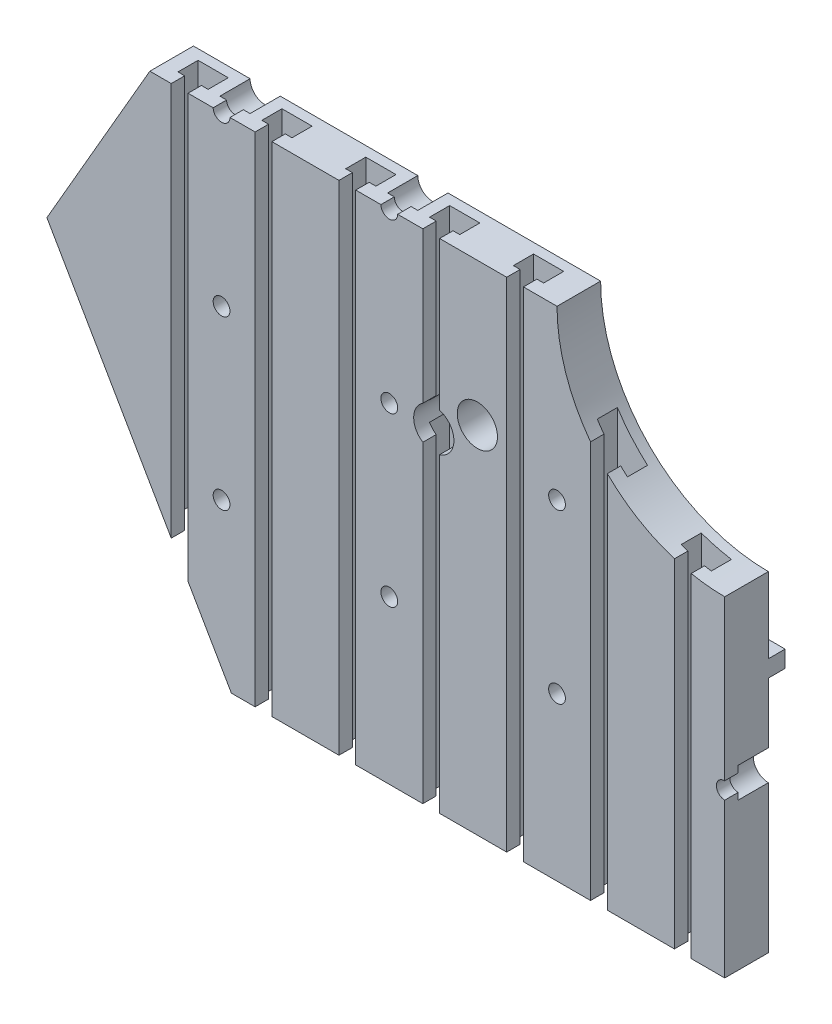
SolidWorks part; units mm, degrees
ref_plane "Plan de face" through (0, 0, 0) normal (0, 0, 1) x (1, 0, 0)
ref_plane "Plan de dessus" through (0, 0, 0) normal (0, 1, 0) x (1, 0, 0)
ref_plane "Plan de droite" through (0, 0, 0) normal (1, 0, 0) x (0, 0, -1)
sketch "Esquisse1" plane through (0, 0, 0) normal (0, 0, 1) x (1, 0, 0)
  line L6 (35.7636, 358.7862) -> (-423.8647, -437.3133) construction
  line L7 (-755.4678, -148.4209) -> (879.7592, -148.4209) construction
  line L8 (-46.1325, 376.7457) -> (415.4529, -422.7436) construction
  line L9 (257.0726, -148.4209) -> (-245.0999, 141.5085) construction
  line L10 (-257.0726, -148.4209) -> (263.2247, 151.9729) construction
  line L11 (-55, 201.5791) -> (55, 201.5791)
  line L12 (-147.0726, -148.4209) -> (147.0726, -148.4209)
  line L13 (147.0726, -148.4209) -> (202.0726, -53.1581)
  line L14 (202.0726, -53.1581) -> (55, 201.5791)
  line L15 (-147.0726, -148.4209) -> (-202.0726, -53.1581)
  line L16 (-202.0726, -53.1581) -> (-55, 201.5791)
  dimension "D1" = 60
  dimension "D2" = 60
  dimension "D3" = 110
  dimension "D4" = 350
  dimension "D5" = 60
  dimension "D6" = 60
  dimension "D7" = 110
  dimension "D8" = 110
extrude "Boss.-Extru.2" add sketch "Esquisse1" along normal blind 13
sketch "Esquisse3" plane through (0, 201.5791, 0) normal (0, 1, 0) x (1, 0, 0)
  line L0 (-12.5, 6.793) -> (-12.5, -19.2478) construction
  line L1 (-8, -3) -> (-17, -3)
  line L2 (-17, -3) -> (-17, -9)
  line L3 (-17, -9) -> (-15, -9)
  line L4 (-15, -9) -> (-15, -13)
  line L5 (55, -13) -> (-55, -13) construction
  line L6 (-10, -9) -> (-10, -13)
  line L7 (-8, -9) -> (-10, -9)
  line L8 (-8, -3) -> (-8, -9)
  line L9 (-15, -13) -> (-10, -13)
  point P2 (-12.5, -13)
  point P14 (-12.5, -3)
  dimension "D1" = 12.5
  dimension "D2" = 9
  dimension "D3" = 5
  dimension "D4" = 6
  dimension "D5" = 4
extrude "Enlèv. mat.-Extru.1" cut sketch "Esquisse3" against normal up to next
pattern_linear "Répétition linéaire1" count 8 spacing 25 along (1, 0, 0) of "Enlèv. mat.-Extru.1"
pattern_linear "Répétition linéaire2" count 7 spacing 25 along (-1, 0, 0) of "Enlèv. mat.-Extru.1"
sketch "3parties" plane through (0, 0, 0) normal (0, 0, 1) x (1, 0, 0)
  line L2 (-50, 0) -> (-171.3817, 0)
  line L3 (-165, 11.0535) -> (-202.0726, -53.1581) construction
  line L4 (50, 0) -> (171.3817, 0)
  line L5 (202.0726, -53.1581) -> (165, 11.0535) construction
  line L6 (0, -50) -> (0, -148.4209)
  line L7 (-10, -148.4209) -> (10, -148.4209) construction
  circle A0 centre (0, 0) radius 50
  dimension "D1" = 100
sketch "certcleRotules" plane through (0, 0, 13) normal (0, 0, 1) x (1, 0, 0)
  circle A0 centre (0, 0) radius 157.5
  dimension "D1" = 315
sketch "Esquisse6" plane through (0, 0, 0) normal (0, 1, 0) x (1, 0, 0)
  line L0 (-157.5, -13) -> (157.5, -13) construction
  line L1 (0, 0) -> (-4.5, 0)
  line L2 (0, 0) -> (0, -13)
  line L3 (-2.5, -9) -> (-4.5, -9)
  line L4 (-4.5, 0) -> (-4.5, -9)
  line L7 (0, -13) -> (-2.5, -13)
  line L8 (-2.5, -9) -> (-2.5, -13)
  dimension "D1" = 4.5
  dimension "D2" = 2.5
  dimension "D3" = 4
revolve "Enlèvement de matière-Révolution1" cut sketch "Esquisse6" angle 360 about L2
pattern_linear "Répétition linéaire3" count 4 spacing 50 along (0, 1, 0) count 4 spacing 50 along (1, 0, 0) of "Enlèvement de matière-Révolution1"
pattern_linear "Répétition linéaire5" count 3 spacing 50 along (0, -1, 0) count 4 spacing 50 along (1, 0, 0) of "Enlèvement de matière-Révolution1"
pattern_linear "Répétition linéaire6" count 4 spacing 50 along (0, 1, 0) count 4 spacing 50 along (-1, 0, 0) of "Enlèvement de matière-Révolution1"
pattern_linear "Répétition linéaire7" count 3 spacing 50 along (0, -1, 0) count 4 spacing 50 along (-1, 0, 0) of "Enlèvement de matière-Révolution1"
sketch "Esquisse8" plane through (0, 0, 0) normal (0, 0, -1) x (-1, 0, 0)
  circle A0 centre (0, 100) radius 4.5 construction
  circle A1 centre (0, 100) radius 4.5
extrude "bouchonBarreauHaut" add sketch "Esquisse8" against normal blind 13
sketch "Esquisse7" plane through (0, 0, 0) normal (0, 0, -1) x (-1, 0, 0)
  line L1 (-6.5, 105.15) -> (6.5, 105.15)
  line L2 (-6.5, 105.15) -> (-6.5, 80.15)
  line L3 (-6.5, 80.15) -> (6.5, 80.15)
  line L4 (6.5, 105.15) -> (6.5, 80.15)
  line L5 (0, 7.15) -> (0, -7.15) construction
  dimension "D1" = 25
  dimension "D2" = 80.15
  dimension "D3" = 13
  dimension "D4" = 6.5
extrude "Boss.-Extru.4" add sketch "Esquisse7" along normal blind 5
sketch "Esquisse9" plane through (0, 0, 0) normal (1, 0, 0) x (0, 0, -1)
  line L0 (5, 80.15) -> (0, 80.15) construction
  line L1 (5, 80.15) -> (5, 105.15) construction
  line L3 (5, 85.15) -> (5, 82.5)
  line L4 (5, 82.5) -> (-3, 82.5)
  line L6 (-3, -148.4209) -> (-3, 201.5791) construction
  line L7 (-13, 157.5) -> (-13, -157.5) construction
  line L8 (-3, 79.15) -> (-13, 79.15)
  line L9 (-3, 79.15) -> (-3, 82.5)
  line L10 (5, 85.15) -> (-13, 85.15)
  line L11 (-13, 79.15) -> (-13, 85.15)
  dimension "D1" = 5
  dimension "D2" = 2.65
  dimension "D3" = 6
revolve "Enlèvement de matière-Révolution2" cut sketch "Esquisse9" angle 360 about L10
pattern_linear "Répétition linéaire8" count 2 spacing 15 along (0, 1, 0) of "Enlèvement de matière-Révolution2"
pattern_circular "Répétition circulaire1" count 3 every 120 about axis through (0, 0, 0) along (0, 0, 1) of "Boss.-Extru.4", "Enlèvement de matière-Révolution2", "Répétition linéaire8"
sketch "Esquisse10" plane through (0, 0, 0) normal (1, 0, 0) x (0, 0, -1)
  line L0 (0, 201.5791) -> (0, -53.1581) construction
  line L1 (0, 77.5) -> (5, 77.5)
  line L2 (0, 77.5) -> (0, 72.5)
  line L3 (0, 72.5) -> (5, 72.5)
  line L4 (5, 77.5) -> (5, 72.5)
  line L5 (0, 50) -> (0, -50) construction
  line L6 (0, -72.5) -> (5, -72.5)
  line L7 (0, -72.5) -> (0, -77.5)
  line L8 (0, -77.5) -> (5, -77.5)
  line L9 (5, -72.5) -> (5, -77.5)
  line L10 (5, 80.15) -> (5, 105.15) construction
  line L11 (-9, 50) -> (0, 50) construction
  line L13 (-9, -100) -> (0, -100) construction
  point P16 (2.5, 72.5)
  point P19 (2.5, -72.5)
  dimension "D1" = 22.5
  dimension "D2" = 5
  dimension "D3" = 22.5
  dimension "D4" = 5
extrude "Boss.-Extru.6" add sketch "Esquisse10" along normal mid plane 215
chamfer "Chanfrein1" distance 5 angle 60 4 edges at (107.5, -75, -5) (-107.5, -75, -5) (-107.5, 75, -5) (107.5, 75, -5)
sketch "Esquisse11" plane through (0, 0, 13) normal (0, 0, 1) x (1, 0, 0)
  line L0 (-10, -148.4209) -> (-10, 201.5791) construction
  line L1 (-10, 23.5) -> (10, 23.5)
  line L2 (-10, 23.5) -> (-10, -23.5)
  line L3 (-10, -23.5) -> (10, -23.5)
  line L4 (10, 23.5) -> (10, -23.5)
  line L5 (10, -148.4209) -> (10, 201.5791) construction
  dimension "D1" = 47
  dimension "D2" = 23.5
extrude "Enlèv. mat.-Extru.2" cut sketch "Esquisse11" against normal blind 8.9
sketch "Esquisse13" plane through (-8, 0, 0) normal (-1, 0, 0) x (0, 0, 1)
  line L1 (4.1, -23.5) -> (11.1, -23.5)
  line L2 (4.1, -23.5) -> (4.1, -40)
  line L3 (4.1, -40) -> (6.1, -40)
  line L4 (11.1, -23.5) -> (11.1, -35)
  arc A0 (6.1, -40) -> (11.1, -35) centre (6.1, -35) ccw
  dimension "D2" = 5
  dimension "D1" = 16.5
  dimension "D3" = 7
extrude "Enlèv. mat.-Extru.3" cut sketch "Esquisse13" against normal up to surface (16 mm away)
sketch "Esquisse14" plane through (0, 0, 4.1) normal (0, 0, 1) x (1, 0, 0)
  line L0 (-8, 23.5) -> (-8, -40) construction
  line L1 (-3, -20) -> (3, -20)
  line L2 (-8, -25) -> (-8, -35)
  line L3 (-3, -40) -> (3, -40)
  line L4 (8, -25) -> (8, -35)
  line L5 (8, -40) -> (8, 23.5) construction
  line L6 (8, -40) -> (-8, -40) construction
  arc A0 (-8, -35) -> (-3, -40) centre (-3, -35) ccw
  arc A1 (3, -40) -> (8, -35) centre (3, -35) ccw
  arc A2 (3, -20) -> (8, -25) centre (3, -25) cw
  arc A3 (-3, -20) -> (-8, -25) centre (-3, -25) ccw
  point P16 (8, -20)
  point P19 (-8, -20)
  dimension "D3" = 5
  dimension "D1" = 20
extrude "Enlèv. mat.-Extru.4" cut sketch "Esquisse14" against normal up to next
mirror "Symétrie1" about plane through (0, 0, 0) normal (0, 1, 0) of "Enlèv. mat.-Extru.4", "Enlèv. mat.-Extru.3"
sketch "Esquisse15" plane through (0, 0, 0) normal (0, 0, -1) x (-1, 0, 0)
  circle A0 centre (-50, 0) radius 4.5 construction
  circle A1 centre (0, -50) radius 4.5 construction
  circle A2 centre (50, 0) radius 4.5 construction
  circle A3 centre (0, 50) radius 4.5 construction
  circle A4 centre (-50, 0) radius 4.5
  circle A5 centre (0, -50) radius 4.5
  circle A6 centre (50, 0) radius 4.5
  circle A7 centre (0, 50) radius 4.5
extrude "boucheTrousCEntre" add sketch "Esquisse15" against normal up to surface (13 mm away)
sketch "Esquisse17" plane through (0, 0, -5) normal (0, 0, -1) x (-1, 0, 0)
  line L12 (0, -148.4209) -> (0, -50)
  line L17 (171.3817, 0) -> (55, 201.5791)
  line L18 (55, 201.5791) -> (-55, 201.5791)
  line L19 (-55, 201.5791) -> (-202.0726, -53.1581)
  line L20 (-202.0726, -53.1581) -> (-147.0726, -148.4209)
  line L21 (-147.0726, -148.4209) -> (0, -148.4209)
  line L22 (171.3817, 0) -> (50, 0)
  arc A2 (0, -50) -> (50, 0) centre (0, 0) ccw
extrude "Enlèv. mat.-Extru.10" cut sketch "Esquisse17" against normal through all contours L12 A2 L22 L17 L18 L19 L20 L21 M25 M24 M23 | L12 M25 M23 M24
